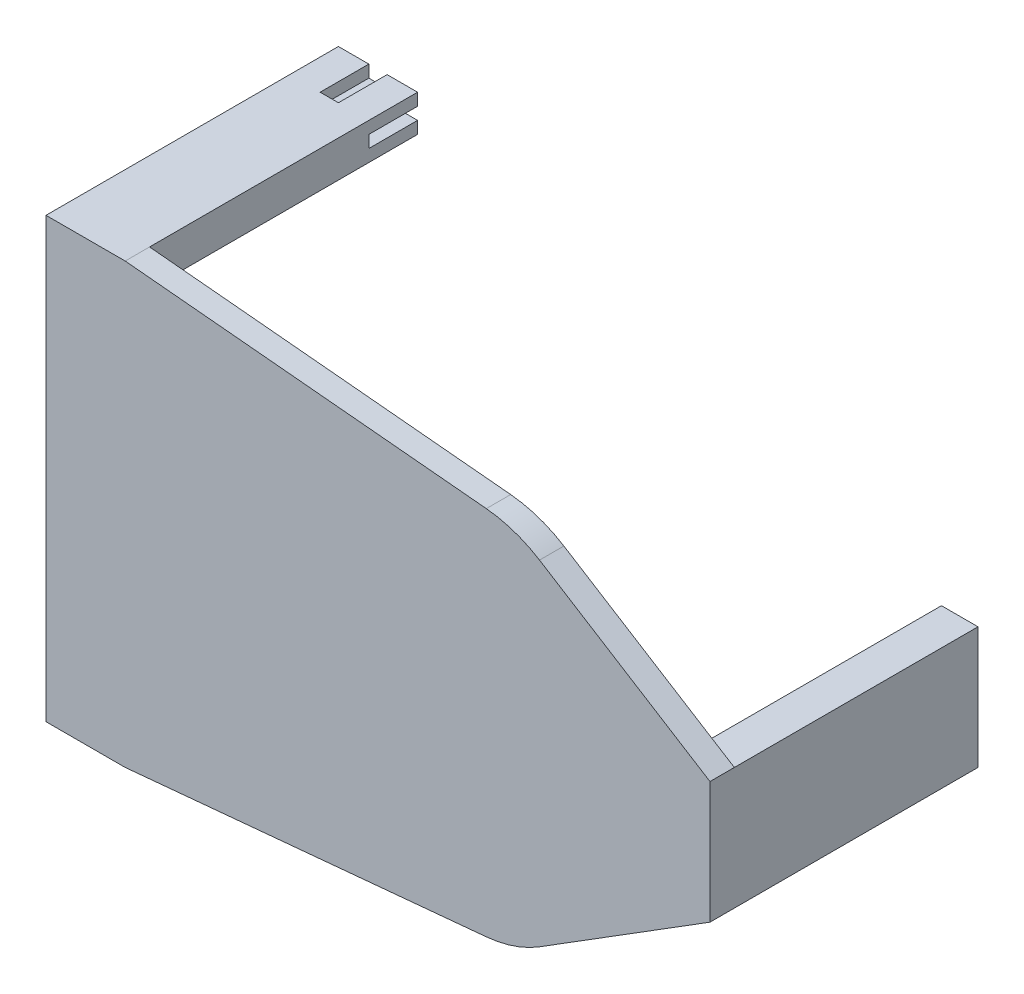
SolidWorks part; units mm, degrees
ref_plane "前视基准面" through (0, 0, 0) normal (0, 0, 1) x (1, 0, 0)
ref_plane "上视基准面" through (0, 0, 0) normal (0, 1, 0) x (1, 0, 0)
ref_plane "右视基准面" through (0, 0, 0) normal (1, 0, 0) x (0, 0, -1)
sketch "草图1" plane through (0, 0, 0) normal (0, 0, 1) x (1, 0, 0)
  line L0 (19.25, 15) -> (35.25, 5)
  line L1 (19.25, 15) -> (-19.25, 15)
  line L2 (19.25, 15) -> (19.25, -15)
  line L3 (19.25, -15) -> (-19.25, -15)
  line L4 (-19.25, 15) -> (-19.25, -15)
  line L5 (19.25, 15) -> (-19.25, -15) construction
  line L6 (19.25, -15) -> (-19.25, 15) construction
  line L7 (35.25, 5) -> (35.25, -5)
  line L8 (35.25, -5) -> (19.25, -15)
  line L9 (19.25, 0) -> (35.25, 0) construction
  point P0 (0, 0)
  dimension "D1" = 38.5
  dimension "D2" = 30
  dimension "D3" = 10
  dimension "D4" = 16
extrude "凸台-拉伸1" add sketch "草图1" along normal blind 2 contours L8 L7 L0 L2 | L1 L4 L3 L2
sketch "草图3" plane through (0, 0, 2) normal (0, 0, 1) x (1, 0, 0)
  line L0 (0, 0) -> (-19.25, 0) construction
  line L1 (-19.25, 15) -> (-12.75, 15)
  line L2 (-19.25, 15) -> (-19.25, 18)
  line L3 (-19.25, 18) -> (-12.75, 18)
  line L4 (-12.75, 15) -> (-12.75, 18)
  line L5 (-19.25, 15) -> (-19.25, -15) construction
  line L6 (-12.75, -15) -> (-12.75, -18)
  line L7 (-19.25, -18) -> (-12.75, -18)
  line L8 (-19.25, -15) -> (-19.25, -18)
  line L9 (-19.25, -15) -> (-12.75, -15)
  dimension "D1" = 6.5
  dimension "D2" = 3
extrude "凸台-拉伸2" add sketch "草图3" against normal blind 20
sketch "草图6" plane through (0, 0, -18) normal (0, 0, -1) x (-1, 0, 0)
  line L0 (16, 18) -> (16, 15) construction
  line L1 (12.75, 18) -> (19.25, 18) construction
  line L2 (12.75, 15) -> (19.25, 15) construction
  line L3 (12.75, 16.5) -> (19.25, 16.5) construction
  line L4 (12.75, 15) -> (12.75, 18) construction
  line L5 (19.25, 18) -> (19.25, 15) construction
  line L7 (17.25, 17) -> (14.75, 17)
  line L8 (17.25, 17) -> (17.25, 16)
  line L9 (17.25, 16) -> (14.75, 16)
  line L10 (14.75, 17) -> (14.75, 16)
  line L11 (17.25, 17) -> (14.75, 16) construction
  line L12 (17.25, 16) -> (14.75, 17) construction
  line L13 (15.25, 17) -> (12.75, 17)
  line L14 (15.25, 17) -> (15.25, 18)
  line L15 (15.25, 18) -> (12.75, 18)
  line L16 (12.75, 17) -> (12.75, 18)
  line L17 (16.75, 17) -> (19.25, 17)
  line L18 (16.75, 17) -> (16.75, 18)
  line L19 (16.75, 18) -> (19.25, 18)
  line L20 (19.25, 17) -> (19.25, 18)
  line L21 (16.75, 16) -> (19.25, 16)
  line L22 (16.75, 16) -> (16.75, 15)
  line L23 (16.75, 15) -> (19.25, 15)
  line L24 (19.25, 16) -> (19.25, 15)
  line L25 (15.25, 16) -> (12.75, 16)
  line L26 (15.25, 16) -> (15.25, 15)
  line L27 (15.25, 15) -> (12.75, 15)
  line L28 (12.75, 16) -> (12.75, 15)
  point P12 (16, 16.5)
  dimension "D1" = 1
  dimension "D2" = 2.5
  dimension "D3" = 2.5
  dimension "D4" = 2.5
  dimension "D5" = 2.5
  dimension "D6" = 2.5
extrude "凸台-拉伸6" add sketch "草图6" along normal blind 4 contours L26 L9 L25 M9 M10 | L7 L10 L9 L8 | L7 L14 L13 M8 M9 | L18 L7 L17 M7 M8 | L9 L22 L21 M10 M7
mirror "镜向3" about plane through (0, 0, 0) normal (0, 1, 0) of "凸台-拉伸6"
sketch "草图7" plane through (0, 0, 0) normal (0, 0, -1) x (-1, 0, 0)
  line L1 (-35.25, -5) -> (-32.25, -5)
  line L2 (-35.25, -5) -> (-35.25, 5)
  line L3 (-35.25, 5) -> (-32.25, 5)
  line L4 (-32.25, -5) -> (-32.25, 5)
  dimension "D1" = 10
  dimension "D2" = 3
extrude "凸台-拉伸7" add sketch "草图7" along normal blind 20
sketch "草图8" plane through (0, 0, -20) normal (0, 0, -1) x (-1, 0, 0)
  line L0 (-33.75, 5) -> (-33.75, 2) construction
  line L1 (-32.25, 5) -> (-35.25, 5) construction
  line L2 (-33.75, 2) -> (-33.75, -2) construction
  line L3 (-32.25, 5) -> (-35.25, 5) construction
  line L4 (-35.25, -5) -> (-32.25, -5) construction
  circle A0 centre (-33.75, 2) radius 1
  circle A1 centre (-33.75, -2) radius 1
  dimension "D1" = 2
  dimension "D2" = 2
  dimension "D4" = 3
  dimension "D3" = 3
extrude "切除-拉伸1" cut sketch "草图8" against normal blind 3
sketch "草图9" plane through (0, 0, 2) normal (0, 0, 1) x (1, 0, 0)
  line L0 (-12.75, 18) -> (19.25, 15)
  line L1 (19.25, 15) -> (-12.75, 15)
  line L2 (-12.75, 15) -> (-12.75, 18)
  line L3 (-12.75, -15) -> (19.25, -15)
  line L4 (19.25, -15) -> (-12.75, -18)
  line L5 (-12.75, -18) -> (-12.75, -15)
extrude "凸台-拉伸8" add sketch "草图9" against normal blind 2
fillet "圆角1" radius 10 2 edges at (19.25, -15, 1) (19.25, 15, 1)
